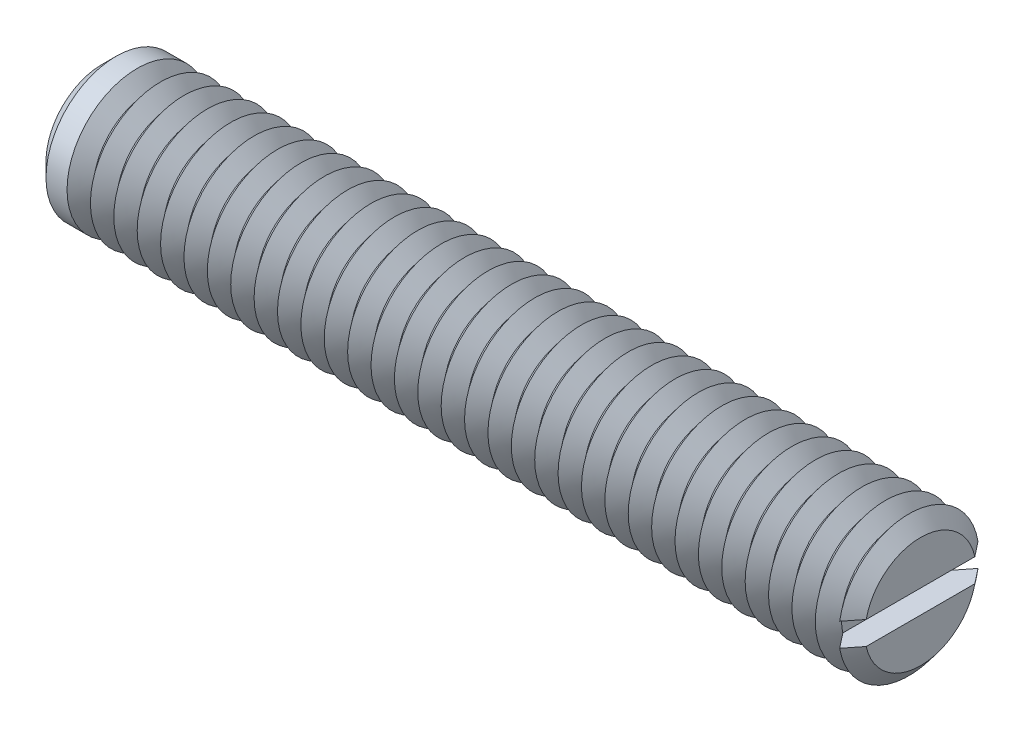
SolidWorks part; units mm, degrees
ref_plane "Front Plane" through (0, 0, 0) normal (0, 0, 1) x (1, 0, 0)
ref_plane "Top Plane" through (0, 0, 0) normal (0, 1, 0) x (1, 0, 0)
ref_plane "Right Plane" through (0, 0, 0) normal (1, 0, 0) x (0, 0, -1)
sketch "Sketch1" plane through (0, 0, 0) normal (1, 0, 0) x (0, 0, -1)
  circle A0 centre (0, 0) radius 3
  dimension "D1" = 6
extrude "Extrude1" add sketch "Sketch1" along normal mid plane 35
sketch "Sketch2" plane through (0, 0, 0) normal (0, 0, 1) x (1, 0, 0)
  line L0 (17.5, 0.5) -> (16.5, 0.5)
  line L1 (17.5, -3) -> (17.5, 3) construction
  line L2 (16.5, 0.5) -> (16.5, -0.5)
  line L3 (0, 0) -> (50000, 0) construction
  line L4 (17.5, -0.5) -> (16.5, -0.5)
  line L5 (17.5, -0.5) -> (17.5, 0.5)
  point P9 (16.5, 0)
  dimension "D1" = 1
extrude "Extrude2" cut sketch "Sketch2" against normal mid plane 9
chamfer "Chamfer1" distance 0.6 angle 45 1 edges at (-17.5, 0, -3)
sketch "Sketch3" plane through (0, 0, 0) normal (0, 0, 1) x (1, 0, 0)
  line L0 (0, 0) -> (30.9602, 0) construction
  line L1 (17, -3) -> (18, -3)
  line L2 (-16.9, -3) -> (17.5, -3) construction
  line L3 (18, -3) -> (17.5, -2.3755)
  line L4 (17.5, -3) -> (17.5, -0.5) construction
  line L5 (17.5, -2.3755) -> (17, -3)
  dimension "D1" = 1
  dimension "D2" = 0.8
revolve "Cut-Revolve1" cut sketch "Sketch3" angle 360 about L0
pattern_linear "LPattern1" count 34 spacing 1 along (-1, 0, 0) of "Cut-Revolve1"
equation "\"D2@Sketch3\" = \"D1@Sketch3\"*0.8"
